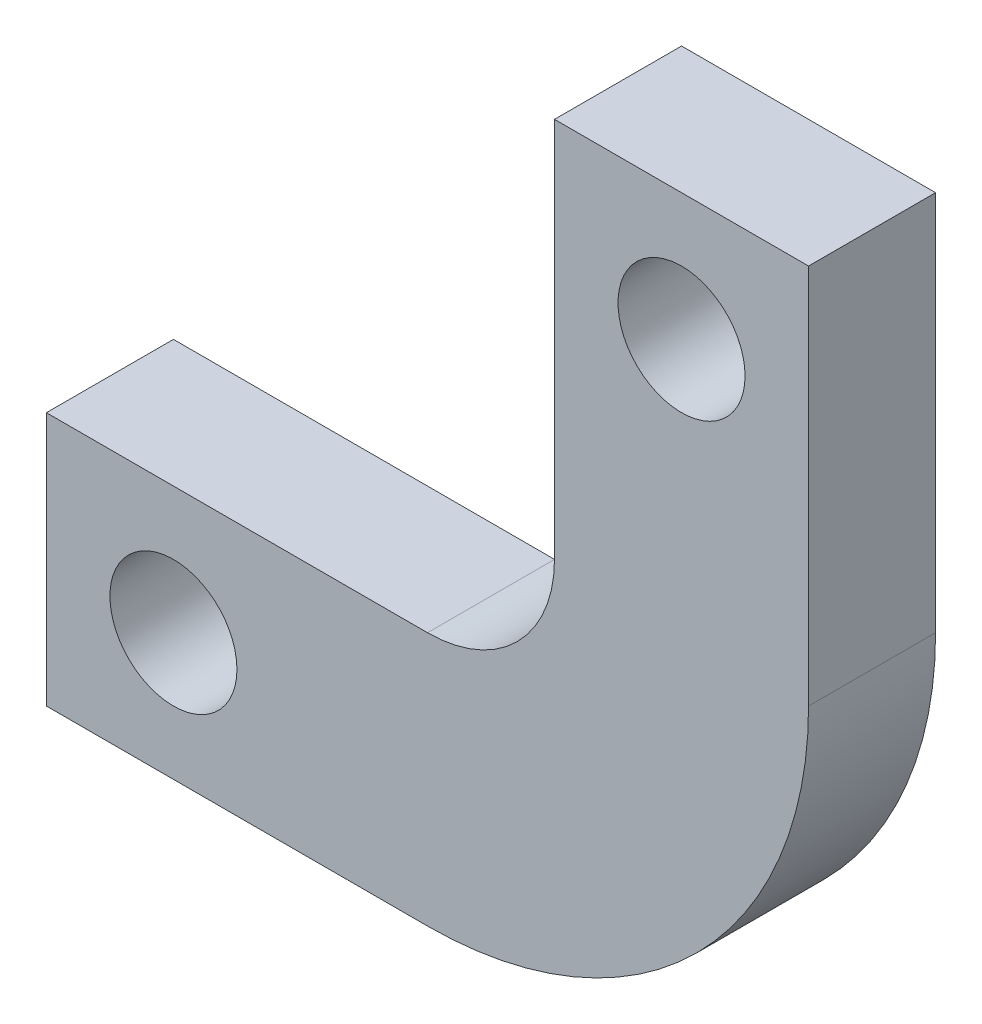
SolidWorks part; units mm, degrees
ref_plane "Front Plane" through (0, 0, 0) normal (0, 0, 1) x (1, 0, 0)
ref_plane "Top Plane" through (0, 0, 0) normal (0, 1, 0) x (1, 0, 0)
ref_plane "Right Plane" through (0, 0, 0) normal (1, 0, 0) x (0, 0, -1)
sketch "Sketch1" plane through (0, 0, 0) normal (0, 0, 1) x (1, 0, 0)
  line L0 (0, 0) -> (18, 0)
  line L1 (36, 18) -> (36, 36)
  line L2 (0, 12) -> (18, 12)
  line L3 (24, 18) -> (24, 36)
  line L4 (0, 0) -> (0, 12)
  line L5 (36, 36) -> (24, 36)
  arc A0 (18, 0) -> (36, 18) centre (18, 18) ccw
  arc A1 (18, 12) -> (24, 18) centre (18, 18) ccw
  circle A3 centre (6, 6) radius 3
  circle A4 centre (30, 30) radius 3
  dimension "D1" = 18
  dimension "D5" = 6
  dimension "D3" = 18
  dimension "D4" = 18
  dimension "D6" = 6
  dimension "D7" = 6
  dimension "D8" = 6
  dimension "D9" = 6
  dimension "D2" = 12
extrude "Boss-Extrude1" add sketch "Sketch1" along normal mid plane 6 from offset 0
